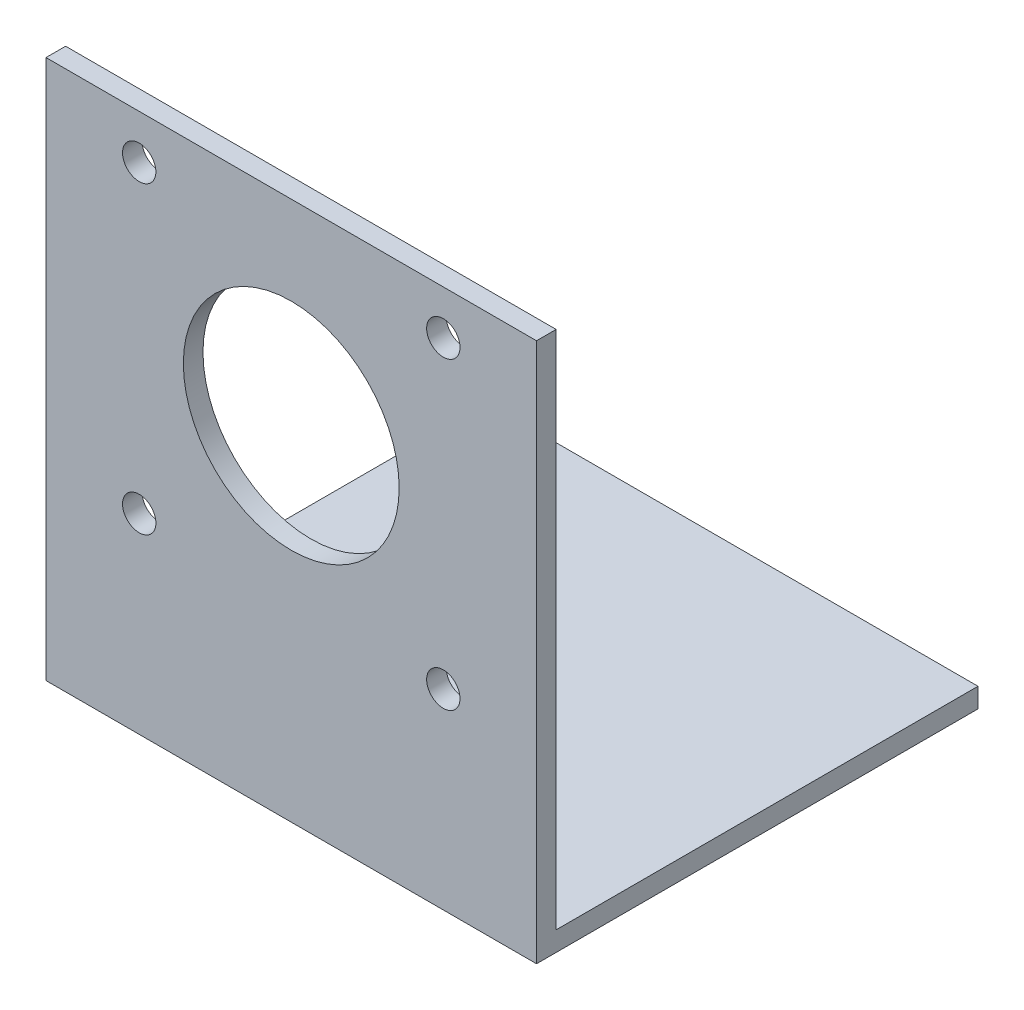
SolidWorks part; units mm, degrees
ref_plane "Front Plane" through (0, 0, 0) normal (0, 0, 1) x (1, 0, 0)
ref_plane "Top Plane" through (0, 0, 0) normal (0, 1, 0) x (1, 0, 0)
ref_plane "Right Plane" through (0, 0, 0) normal (1, 0, 0) x (0, 0, -1)
sketch "Sketch1" plane through (0, 0, 0) normal (0, 0, 1) x (1, 0, 0)
  line L1 (-25, 0) -> (25, 0)
  line L2 (-25, 0) -> (-25, 55)
  line L3 (-25, 55) -> (25, 55)
  line L4 (25, 0) -> (25, 55)
  dimension "D1" = 25
  dimension "D2" = 25
  dimension "D3" = 55
extrude "Boss-Extrude1" add sketch "Sketch1" against normal blind 2
sketch "Sketch2" plane through (0, 0, 0) normal (0, 0, 1) x (1, 0, 0)
  line L1 (-25, 0) -> (25, 0)
  line L2 (-25, 0) -> (-25, 2)
  line L3 (-25, 2) -> (25, 2)
  line L4 (25, 0) -> (25, 2)
  dimension "D1" = 25
  dimension "D2" = 25
  dimension "D3" = 2
extrude "Boss-Extrude2" add sketch "Sketch2" against normal blind 45
sketch "Sketch3" plane through (0, 0, 0) normal (0, 0, 1) x (1, 0, 0)
  circle A0 centre (-15.5, 19.5) radius 1.7
  circle A1 centre (-15.5, 50.5) radius 1.7
  circle A2 centre (15.5, 19.5) radius 1.7
  circle A3 centre (15.5, 50.5) radius 1.7
  dimension "D1" = 3.4
  dimension "D2" = 15.5
  dimension "D3" = 15.5
  dimension "D4" = 19.5
  dimension "D5" = 50.5
extrude "Cut-Extrude1" cut sketch "Sketch3" along normal through all and the other way through all
sketch "Sketch4" plane through (0, 0, 0) normal (0, 0, 1) x (1, 0, 0)
  circle A0 centre (0, 35) radius 11
  dimension "D1" = 22
  dimension "D2" = 35
extrude "Lo_tam_D22" cut sketch "Sketch4" along normal through all and the other way through all
